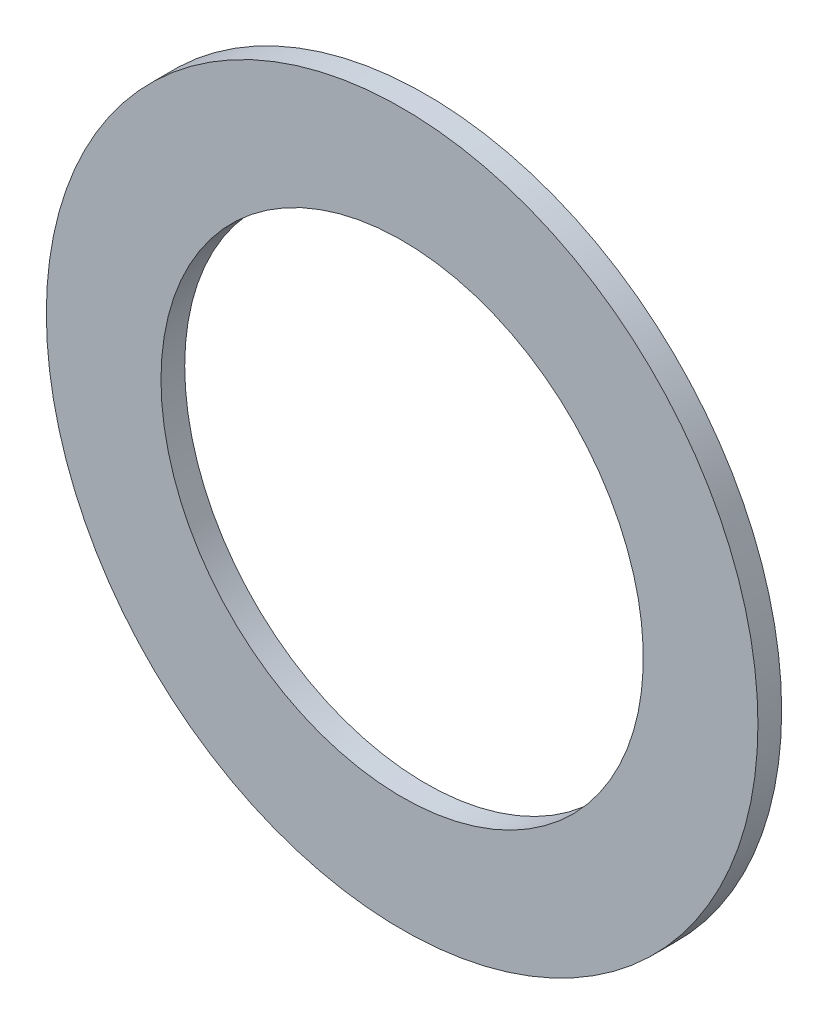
SolidWorks part; units mm, degrees
ref_plane "Plane1" through (0, 0, 0) normal (0, 0, 1) x (1, 0, 0)
ref_plane "Plane2" through (0, 0, 0) normal (0, 1, 0) x (1, 0, 0)
ref_plane "Plane3" through (0, 0, 0) normal (1, 0, 0) x (0, 0, -1)
sketch "Esquisse1" plane through (0, 0, 0) normal (0, 0, 1) x (1, 0, 0)
  circle A0 centre (0, 0) radius 6.1
  circle A1 centre (0, 0) radius 9
  dimension "D1" = 12.2
  dimension "D2" = 18
extrude "Base-Extrusion" add sketch "Esquisse1" along normal blind 0.6
